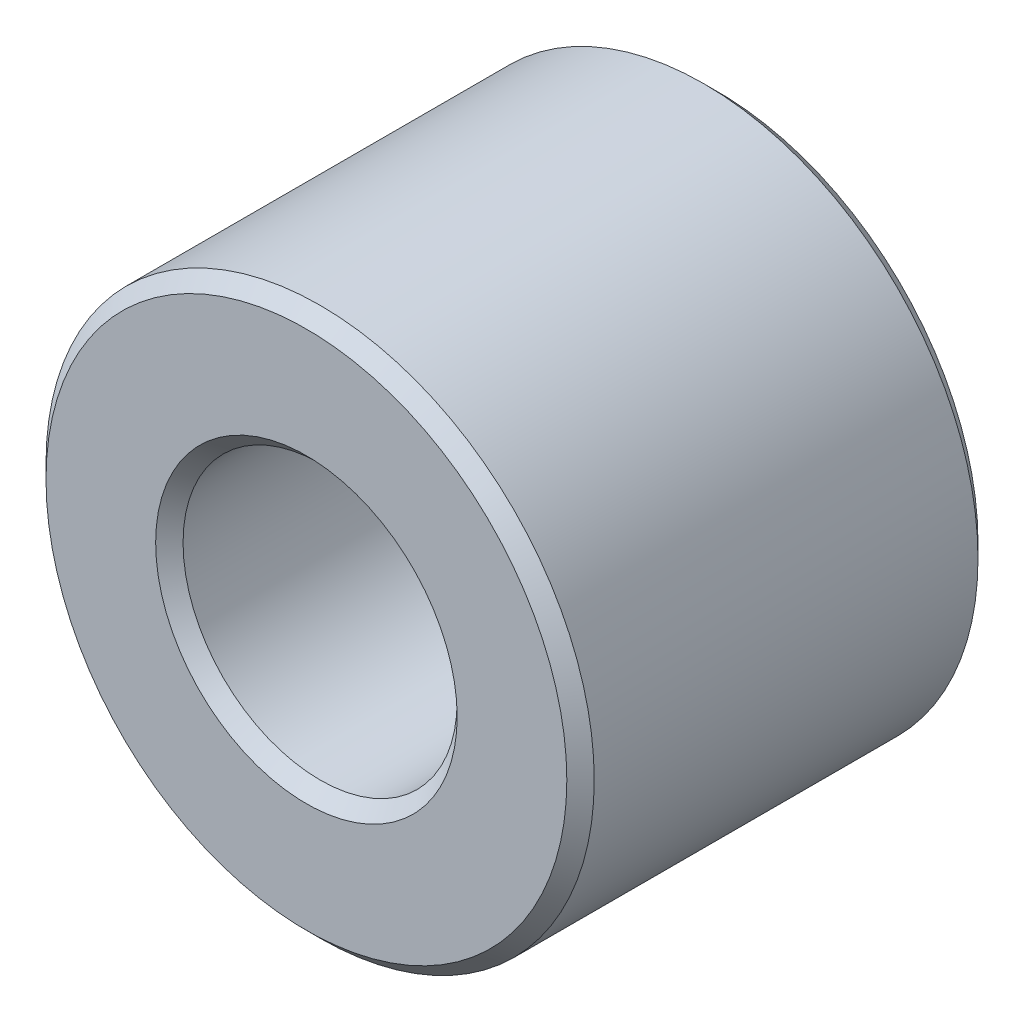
SolidWorks part; units mm, degrees
ref_plane "Front Plane" through (0, 0, 0) normal (0, 0, 1) x (1, 0, 0)
ref_plane "Top Plane" through (0, 0, 0) normal (0, 1, 0) x (1, 0, 0)
ref_plane "Right Plane" through (0, 0, 0) normal (1, 0, 0) x (0, 0, -1)
sketch "Sketch1" plane through (0, 0, 0) normal (0, 0, 1) x (1, 0, 0)
  circle A0 centre (0, 0) radius 15
  circle A1 centre (0, 0) radius 30
  dimension "D1" = 30
  dimension "D2" = 60
extrude "Boss-Extrude1" add sketch "Sketch1" along normal mid plane 45
chamfer "Chamfer1" distance 1.5 angle 45 4 edges at (15, 0, -22.5) (30, 0, -22.5) (15, 0, 22.5) (30, 0, 22.5)
